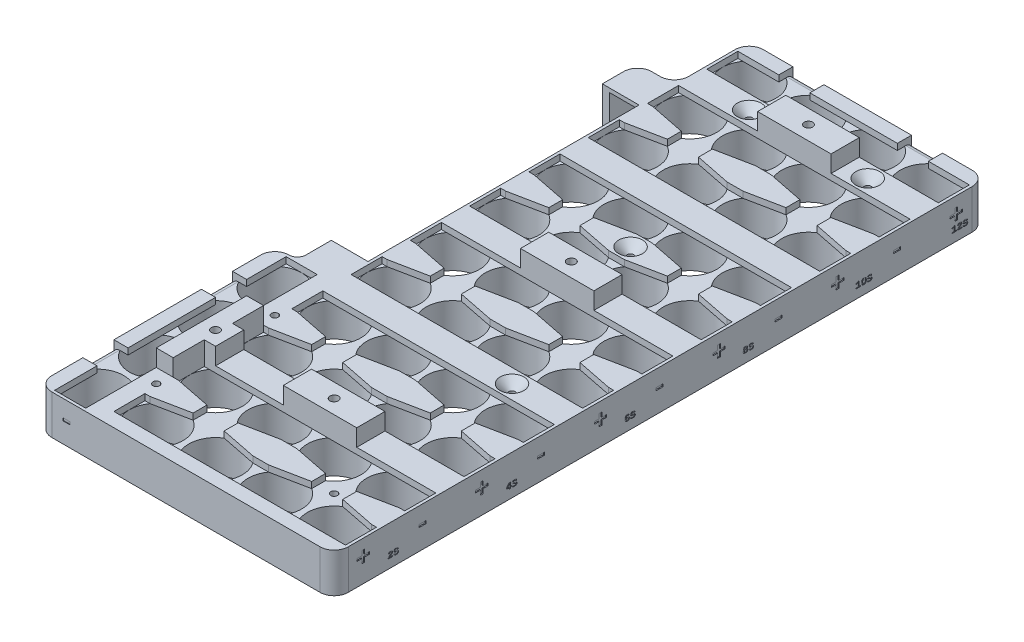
SolidWorks part; units mm, degrees
other "<Support 12S4P>-<Enlèv. mat.-Extru.14>" parameters "D3"=42
ref_plane "Plan de face" through (0, 0, 0) normal (0, 0, 1) x (1, 0, 0)
ref_plane "Plan de dessus" through (0, 0, 0) normal (0, 1, 0) x (1, 0, 0)
ref_plane "Plan de droite" through (0, 0, 0) normal (1, 0, 0) x (0, 0, -1)
ref_plane "Plan de face-Support 12S4P B_Symétrique" through (0, 0, 0) normal (0, 0, 1) x (1, 0, 0)
ref_plane "Plan de dessus-Support 12S4P B_Symétrique" through (0, 0, 0) normal (0, -1, 0) x (1, 0, 0)
ref_plane "Plan de droite-Support 12S4P B_Symétrique" through (0, 0, 0) normal (1, 0, 0) x (0, 0, -1)
ref_plane "Plan1-Support 12S4P B_Symétrique" through (0, 1, 0) normal (0, -1, 0) x (1, 0, 0)
mirrored part "Support 12S4P B_Symétrique"
sketch "Esquisse1" plane through (0, 0, 0) normal (0, 1, 0) x (1, 0, 0)
  line L0 (2.7847, 16) -> (15.5, 18.5483)
  line L1 (15.5, 18.5483) -> (15.5, 23.4517)
  line L2 (15.5, 23.4517) -> (2.7847, 26)
  line L3 (-41, 26) -> (41, 26) construction
  line L4 (2.7847, 26) -> (39.2153, 26)
  line L5 (39.2153, 26) -> (26.5, 23.4517)
  line L6 (26.5, 23.4517) -> (26.5, 18.5483)
  line L7 (26.5, 18.5483) -> (39.2153, 16)
  line L8 (39.2153, 16) -> (2.7847, 16)
  line L9 (21, 26) -> (21, 16) construction
  line L10 (21, 37) -> (21, 26) construction
  line L11 (15.5, 21) -> (26.5, 21) construction
  line L12 (18.2153, 37) -> (23.7847, 37) construction
  arc A0 (18.2153, 26) -> (18.2153, 37) centre (10.5, 31.5) ccw construction
  point P15 (21, 21)
extrude "Enlèv. mat.-Extru.1" cut sketch "Esquisse1" against normal up to surface (2.2 mm away)
pattern_linear "Répétition linéaire1" count 2 spacing 42 along (-1, 0, 0) of "Enlèv. mat.-Extru.1"
pattern_linear "Répétition linéaire2" count 5 spacing 42 along (0, 0, -1) of "Répétition linéaire1", "Enlèv. mat.-Extru.1"
sketch "Esquisse2" plane through (42, 0, 0) normal (1, 0, 0) x (0, 0, -1)
  line L0 (7.714, -8.2626) -> (223.2184, -8.2626) construction
  text T0 "+ - + - + - + - + - +" font "Liberation Mono" height 5.26
extrude "Enlèv. mat.-Extru.2" cut sketch "Esquisse2" against normal blind 0.35
sketch "Esquisse3" plane through (0, 0, 0) normal (0, 0, 1) x (1, 0, 0)
  line L0 (-58, -8.4876) -> (-47.6044, -8.4876) construction
  line L1 (-58, -14) -> (-58, 0) construction
  text T0 "-" font "Liberation Mono" height 5.26
extrude "Enlèv. mat.-Extru.3" cut sketch "Esquisse3" against normal blind 0.2
sketch "Esquisse4" plane through (42, 0, 0) normal (1, 0, 0) x (0, 0, -1)
  line L0 (18.9476, -10.8505) -> (226, -10.8505) construction
  line L2 (226, 0) -> (226, -14) construction
  text T0 "2S                   4S                   6S                   8S                  1OS              12S" font "Liberation Mono" height 2
extrude "Enlèv. mat.-Extru.4" cut sketch "Esquisse4" against normal blind 0.2
sketch "Esquisse5" [suppressed] plane through (0, 0, 0) normal (0, 1, 0) x (1, 0, 0)
  line L0 (-42, 189) -> (0, 189)
  line L1 (-42, 226) -> (-42, 84) construction
  line L2 (0, 189) -> (0, 231)
  line L3 (37, 231) -> (-37, 231) construction
  line L4 (0, 231) -> (51.3752, 231)
  line L5 (51.3752, 231) -> (51.3752, 0)
  line L6 (51.3752, 0) -> (-80.6982, 0)
  line L7 (-80.6982, 0) -> (-80.6982, 189)
  line L8 (-80.6982, 189) -> (-42, 189)
  line L9 (-15.5, 186.5483) -> (-15.5, 191.4517) construction
  point P4 (-15.5, 189)
extrude "Enlèv. mat.-Extru.5" [suppressed] cut sketch "Esquisse5" against normal through all
sketch "Esquisse7" [suppressed] plane through (0, 0, 0) normal (0, 1, 0) x (1, 0, 0)
  line L0 (-31.5, 199.5) -> (-10.5, 220.5) construction
  arc A0 (-2.7847, 215) -> (-2.7847, 226) centre (-10.5, 220.5) ccw construction
  arc A1 (-39.2153, 205) -> (-39.2153, 194) centre (-31.5, 199.5) ccw construction
  circle A2 centre (-21, 210) radius 1.5
  arc A3 (0, 211.5) -> (0, 208.5) centre (0, 210) ccw construction
extrude "Enlèv. mat.-Extru.6" [suppressed] cut sketch "Esquisse7" against normal through all
chamfer "Chanfrein1" [suppressed] distance 2.5 angle 45
sketch "Esquisse6" [suppressed] plane through (0, 0, 0) normal (0, 1, 0) x (1, 0, 0)
  line L0 (0, 214.1) -> (0, 205.9)
  arc A0 (0, 214.1) -> (0, 205.9) centre (0, 210) ccw construction
  arc A1 (0, 214.1) -> (0, 205.9) centre (0, 210) ccw
extrude "Boss.-Extru.1" [suppressed] add sketch "Esquisse6" against normal up to surface (12 mm away)
fillet "Congé1" [suppressed] radius 6
chamfer "Chanfrein2" distance 3 angle 45 4 edges at (0, 0, -148.2) (-21, 0, -211.2) (21, 0, -211.2) (21, 0, -85.2)
sketch "Esquisse9" plane through (0, 0, 0) normal (0, 1, 0) x (1, 0, 0)
  line L0 (-58, 1) -> (-58, 83) construction
  line L1 (-58, 69) -> (-63, 69)
  line L2 (-58, 69) -> (-58, 58)
  line L3 (-58, 58) -> (-63, 58)
  line L4 (-63, 69) -> (-63, 58)
  line L5 (-63, 79) -> (-63, 5) construction
  line L6 (-41, 47) -> (-41, 58) construction
  line L7 (-58, 27) -> (-63, 27)
  line L8 (-58, 27) -> (-58, 16)
  line L9 (-58, 16) -> (-63, 16)
  line L10 (-63, 27) -> (-63, 16)
  line L11 (-41, 26) -> (-41, 37) construction
  line L12 (-41, 16) -> (-39.2153, 16) construction
  line L15 (-41, 58) -> (-39.2153, 58) construction
extrude "Enlèv. mat.-Extru.8" cut sketch "Esquisse9" against normal up to surface (2.2 mm away)
sketch "Esquisse10" plane through (0, 0, 0) normal (0, 1, 0) x (1, 0, 0)
  line L0 (37, 231) -> (-37, 231) construction
  line L1 (-26.5, 231) -> (-15.5, 231)
  line L2 (-26.5, 231) -> (-26.5, 226)
  line L3 (-26.5, 226) -> (-15.5, 226)
  line L4 (-15.5, 231) -> (-15.5, 226)
  line L5 (-41, 226) -> (41, 226) construction
  line L6 (-41, 215) -> (-41, 226) construction
  line L7 (15.5, 231) -> (26.5, 231)
  line L8 (15.5, 231) -> (15.5, 226)
  line L9 (15.5, 226) -> (26.5, 226)
  line L10 (26.5, 231) -> (26.5, 226)
  line L11 (-31.5, 220.5) -> (-10.5, 220.5) construction
  line L12 (21, 226) -> (21, 220.5) construction
  line L13 (-21, 226) -> (-21, 220.5) construction
  line L16 (31.5, 220.5) -> (10.5, 220.5) construction
extrude "Enlèv. mat.-Extru.9" cut sketch "Esquisse10" against normal up to surface (2.2 mm away)
fillet "Congé2" radius 2 4 edges at (-63, -2.2, -63.5) (-63, -2.2, -21.5) (-21, -2.2, -231) (21, -2.2, -231)
sketch "Esquisse11" plane through (0, 0, 0) normal (0, 1, 0) x (1, 0, 0)
  line L0 (-41, 215) -> (41, 215) construction
  line L1 (-13, 215) -> (13, 215)
  line L2 (-13, 215) -> (-13, 205)
  line L3 (-13, 205) -> (13, 205)
  line L4 (13, 215) -> (13, 205)
  line L5 (-41, 205) -> (41, 205) construction
  line L6 (-41, 47) -> (41, 47) construction
  line L7 (-13, 47) -> (13, 47)
  line L8 (-13, 47) -> (-13, 37)
  line L9 (-13, 37) -> (13, 37)
  line L10 (13, 47) -> (13, 37)
  line L11 (-41, 37) -> (41, 37) construction
  line L12 (-47, 83) -> (-47, 1) construction
  line L13 (-47, 58) -> (-41, 58)
  line L14 (-47, 58) -> (-47, 26)
  line L15 (-47, 26) -> (-41, 26)
  line L16 (-41, 58) -> (-41, 47)
  line L17 (-41, 131) -> (41, 131) construction
  line L18 (-13, 131) -> (13, 131)
  line L19 (-13, 131) -> (-13, 121)
  line L20 (-13, 121) -> (13, 121)
  line L21 (13, 131) -> (13, 121)
  line L22 (-41, 121) -> (41, 121) construction
  line L23 (-13, 210) -> (13, 210) construction
  line L24 (-47, 42) -> (-37, 42) construction
  line L25 (-41, 47) -> (-37, 47)
  line L27 (-41, 37) -> (-37, 37)
  line L28 (-37, 47) -> (-37, 37)
  line L29 (-41, 37) -> (-41, 26)
  circle A2 centre (-42, 42) radius 1.5 construction
  circle A3 centre (0, 42) radius 1.5 construction
  circle A5 centre (-42, 42) radius 1.5
  circle A6 centre (0, 42) radius 1.5
  circle A9 centre (0, 210) radius 1.5 construction
  circle A10 centre (0, 210) radius 1.5
  circle A11 centre (0, 126) radius 1.5 construction
  circle A12 centre (0, 126) radius 1.5
  point P34 (0, 210)
  dimension "D1" = 26
extrude "Boss.-Extru.2" add sketch "Esquisse11" along normal blind 6 and the other way up to surface
equation "\"L\"= 21"
equation "\"D3@Répétition linéaire1\"=\"L\"*2"
equation "\"D3@Répétition linéaire2\"=\"L\"*2"
